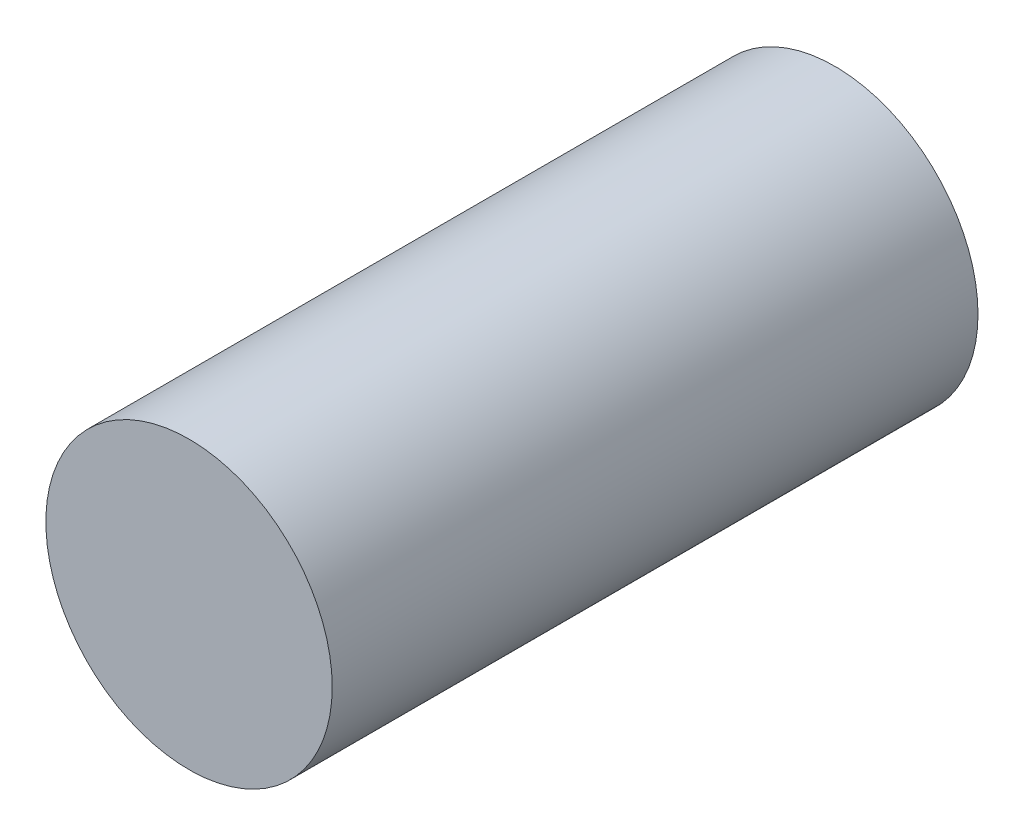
SolidWorks part; units mm, degrees
ref_plane "Ebene vorne" through (0, 0, 0) normal (0, 0, 1) x (1, 0, 0)
ref_plane "Ebene oben" through (0, 0, 0) normal (0, 1, 0) x (1, 0, 0)
ref_plane "Ebene rechts" through (0, 0, 0) normal (1, 0, 0) x (0, 0, -1)
sketch "Skizze1" plane through (0, 0, 0) normal (0, 0, 1) x (1, 0, 0)
  circle A0 centre (0, 0) radius 10
  dimension "D1" = 20
extrude "Aufsatz-Linear austragen1" add sketch "Skizze1" against normal blind 45.1
